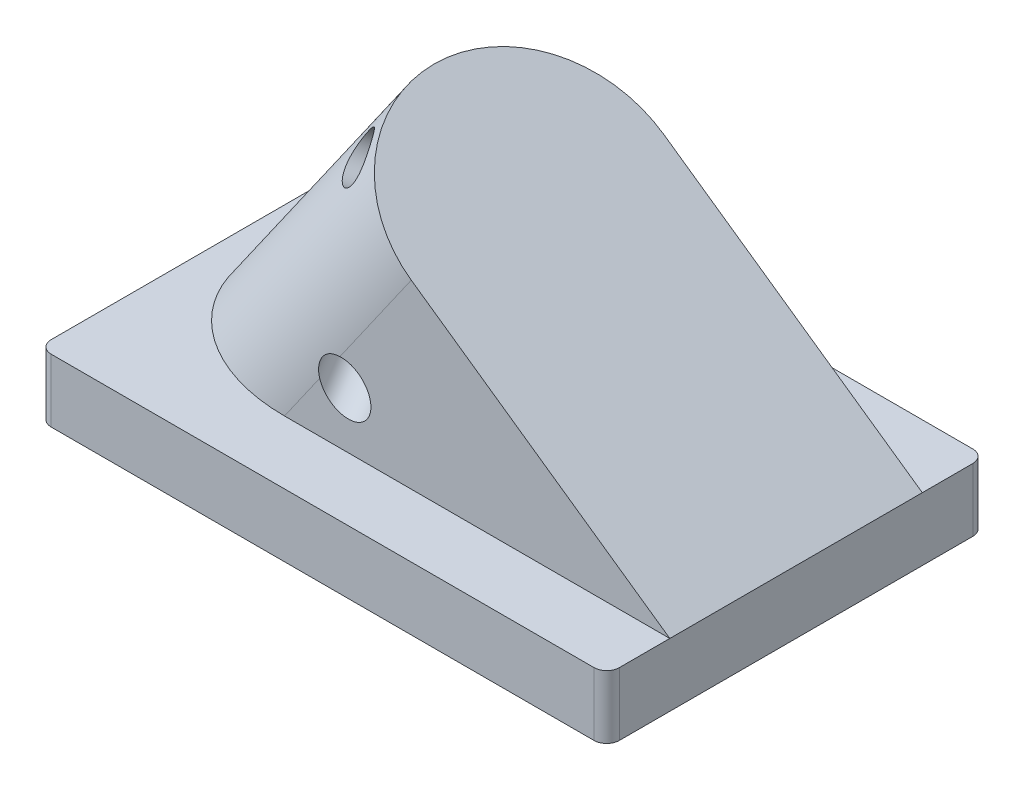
SolidWorks part; units mm, degrees
ref_plane "Front Plane" through (0, 0, 0) normal (0, 0, 1) x (1, 0, 0)
ref_plane "Top Plane" through (0, 0, 0) normal (0, 1, 0) x (1, 0, 0)
ref_plane "Right Plane" through (0, 0, 0) normal (1, 0, 0) x (0, 0, -1)
sketch "Sketch1" plane through (0, 0, 0) normal (0, 1, 0) x (1, 0, 0)
  line L1 (-57.15, -38.1) -> (57.15, -38.1)
  line L2 (-57.15, -38.1) -> (-57.15, 38.1)
  line L3 (-57.15, 38.1) -> (57.15, 38.1)
  line L4 (57.15, -38.1) -> (57.15, 38.1)
  line L5 (-57.15, -38.1) -> (57.15, 38.1) construction
  line L6 (-57.15, 38.1) -> (57.15, -38.1) construction
  point P0 (0, 0)
  dimension "D1" = 76.2
  dimension "D2" = 114.3
extrude "Boss-Extrude1" add sketch "Sketch1" along normal blind 12.7
ref_plane "Plane1" through (24.7688, 35.3735, 0) normal (0.5736, 0.8192, 0) x (0, 0, -1)
sketch "Sketch2" plane through (24.7688, 35.3735, 0) normal (0.5736, 0.8192, 0) x (0, 0, -1)
  line L0 (-25.4, 23.9699) -> (-25.4, -39.5301)
  line L1 (-38.1, -39.5301) -> (38.1, -39.5301) construction
  line L2 (-25.4, -39.5301) -> (25.4, -39.5301)
  line L3 (25.4, -39.5301) -> (25.4, 23.9699)
  arc A0 (25.4, 23.9699) -> (-25.4, 23.9699) centre (0, 23.9699) ccw
  dimension "D1" = 50.8
  dimension "D2" = 63.5
extrude "Boss-Extrude2" add sketch "Sketch2" against normal up to surface
ref_plane "Plane5" through (-40.4414, 28.3174, 0) normal (-0.8192, 0.5736, 0) x (0, 0, 1)
sketch "Sketch14" plane through (-40.4414, 28.3174, 0) normal (-0.8192, 0.5736, 0) x (0, 0, 1)
  line L0 (25.4, 43.1831) -> (-25.4, 43.1831) construction
  circle A0 centre (0, -1.2669) radius 4.7625
  point P2 (0, 0)
  dimension "D1" = 9.525
  dimension "D2" = 44.45
extrude "Cut-Extrude2" cut sketch "Sketch14" against normal blind 12.7
ref_plane "Plane2" through (-24.5299, 17.176, 29.9455) normal (-0.5792, 0.4056, 0.7071) x (0.5736, 0.8192, 0)
hole_wizard "3/8 (0.375) Diameter Hole2" positions "Sketch5" profile "Sketch7" hole size "3/8" standard "ANSI Inch"
sketch "Sketch5" plane through (-24.5299, 17.176, 29.9455) normal (-0.5792, 0.4056, 0.7071) x (0.5736, 0.8192, 0)
  line L0 (43.1831, -1.0112) -> (43.1831, 42.3493) construction
  line L1 (-1.2801, -1.0112) -> (43.1831, -1.0112) construction
  point P0 (35.2329, 21.2138)
  dimension "D1" = 7.9502
  dimension "D2" = 22.225
sketch "Sketch7" plane through (-16.6087, 54.641, 14.9451) normal (0.6967, 0.6967, 0.1711) x (0.4232, -0.5917, 0.6861)
  line L0 (0, 0) -> (0, 57.0565)
  line L1 (0, 57.0565) -> (4.7625, 57.0565)
  line L2 (4.7625, 57.0565) -> (4.7625, 0)
  line L5 (4.7625, 0) -> (0, 0)
  line L11 (0, -6.35) -> (0, 107.95) construction
  dimension "Thru Hole Dia." = 9.525
  dimension "Thru Hole Depth" = 57.0565
ref_plane "Plane3" through (-57.5985, 10.1562, 0) normal (-0.9848, 0.1736, 0) x (0, 0, 1)
sketch "Sketch8" plane through (-57.5985, 10.1562, 0) normal (-0.9848, 0.1736, 0) x (0, 0, 1)
  line L0 (-38.1, -9.924) -> (38.1, -9.924) construction
  line L1 (-38.1, 2.5831) -> (38.1, 2.5831) construction
  line L2 (-32.0763, -9.924) -> (32.0763, -9.924)
  arc A0 (-32.0763, -9.924) -> (32.0763, -9.924) centre (0, -64.7269) cw
  dimension "D1" = 63.5
  dimension "D2" = 67.31
extrude "Cut-Extrude1" cut sketch "Sketch8" against normal through all
ref_plane "Plane4" through (-15.312, 10.7216, -32.3763) normal (-0.4096, 0.2868, -0.866) x (0.5736, 0.8192, 0)
hole_wizard "3/8 (0.375) Diameter Hole3" positions "Sketch10" profile "Sketch12" hole size "3/8" standard "ANSI Inch"
sketch "Sketch10" plane through (-15.312, 10.7216, -32.3763) normal (-0.4096, 0.2868, -0.866) x (0.5736, 0.8192, 0)
  line L0 (-1.2801, -8.0585) -> (43.1831, -8.0585) construction
  line L2 (43.1831, -46.1585) -> (43.1831, -8.0585) construction
  point P0 (14.6081, -30.2835)
  dimension "D1" = 22.225
  dimension "D2" = 28.575
sketch "Sketch12" plane through (-28.4164, 37.7306, -17.2345) normal (0.7036, 0.7036, -0.0998) x (-0.5807, 0.6502, 0.4899)
  line L0 (0, 0) -> (0, 93.7878)
  line L1 (0, 93.7878) -> (4.7625, 93.7878)
  line L2 (4.7625, 93.7878) -> (4.7625, 0)
  line L5 (4.7625, 0) -> (0, 0)
  line L11 (0, -6.35) -> (0, 107.95) construction
  dimension "Thru Hole Dia." = 9.525
  dimension "Thru Hole Depth" = 93.7878
fillet "Fillet1" radius 2.54 4 edges at (-57.15, 6.35, -38.1) (57.15, 6.35, -38.1) (57.15, 6.35, 38.1) (-57.15, 6.35, 38.1)
